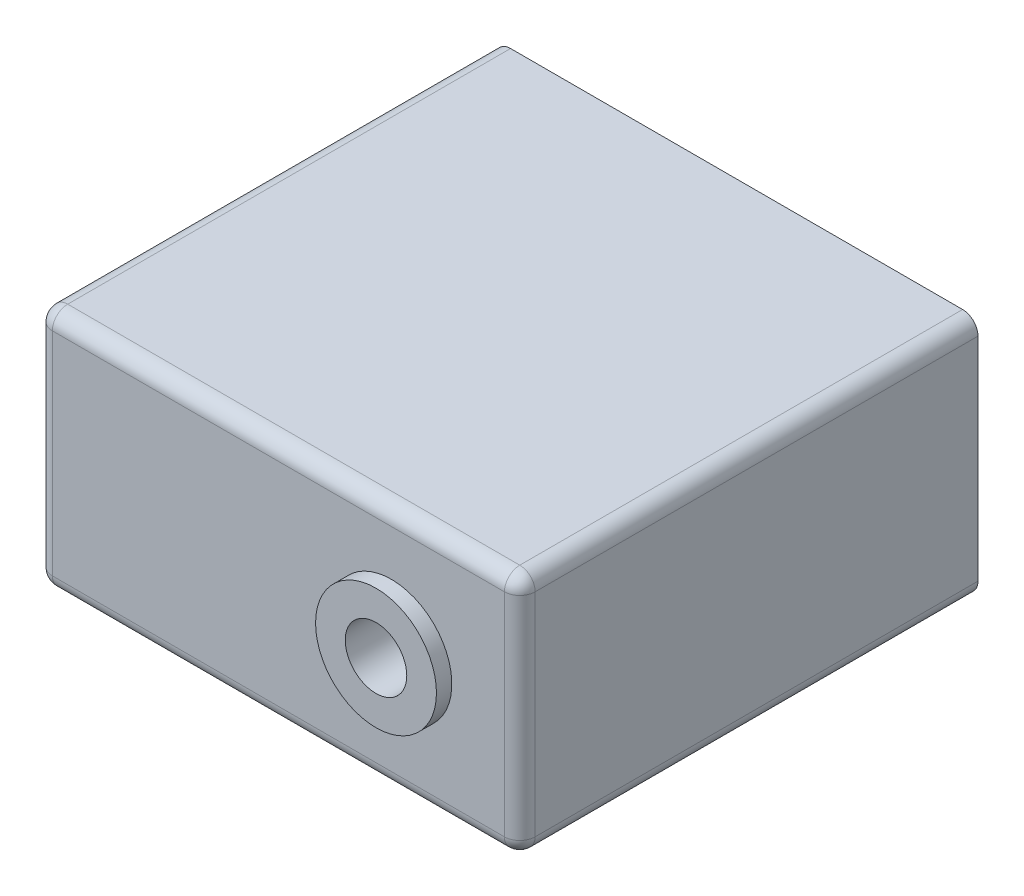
SolidWorks part; units mm, degrees
ref_plane "Front Plane" through (0, 0, 0) normal (0, 0, 1) x (1, 0, 0)
ref_plane "Top Plane" through (0, 0, 0) normal (0, 1, 0) x (1, 0, 0)
ref_plane "Right Plane" through (0, 0, 0) normal (1, 0, 0) x (0, 0, -1)
sketch "Sketch2" plane through (0, 0, 0) normal (0, 0, 1) x (1, 0, 0)
  line L1 (0, 0) -> (39.878, 0)
  line L2 (0, 0) -> (0, 20.066)
  line L3 (0, 20.066) -> (39.878, 20.066)
  line L4 (39.878, 0) -> (39.878, 20.066)
  dimension "D1" = 39.878
  dimension "D2" = 20.066
extrude "Boss-Extrude1" add sketch "Sketch2" along normal blind 37.846
fillet "Fillet1" radius 1.27 8 edges at (0, 10.033, 37.846) (19.939, 0, 37.846) (39.878, 10.033, 37.846) (19.939, 20.066, 37.846) (39.878, 20.066, 18.923) (0, 20.066, 18.923) (39.878, 0, 18.923) (0, 0, 18.923)
sketch "Sketch3" plane through (0, 0, 37.846) normal (0, 0, 1) x (1, 0, 0)
  line L0 (1.27, 10.033) -> (38.608, 10.033)
  line L1 (1.27, 18.796) -> (1.27, 1.27) construction
  line L2 (38.608, 1.27) -> (38.608, 18.796) construction
  line L3 (38.608, 10.033) -> (19.939, 10.033)
  line L4 (19.939, 10.033) -> (29.2735, 10.033)
  circle A0 centre (29.2735, 10.033) radius 4.9912
extrude "Boss-Extrude2" add sketch "Sketch3" along normal blind 1.27 contours A0
sketch "Sketch4" plane through (0, 0, 39.116) normal (0, 0, 1) x (1, 0, 0)
  line L0 (29.2735, 15.0242) -> (29.2735, 5.0418)
  circle A0 centre (29.2735, 10.033) radius 4.9912 construction
  circle A1 centre (29.2735, 10.033) radius 4.9912 construction
  circle A2 centre (29.2735, 10.033) radius 2.54
  dimension "D1" = 5.08
extrude "Cut-Extrude1" cut sketch "Sketch4" against normal blind 5.08 contours A2
